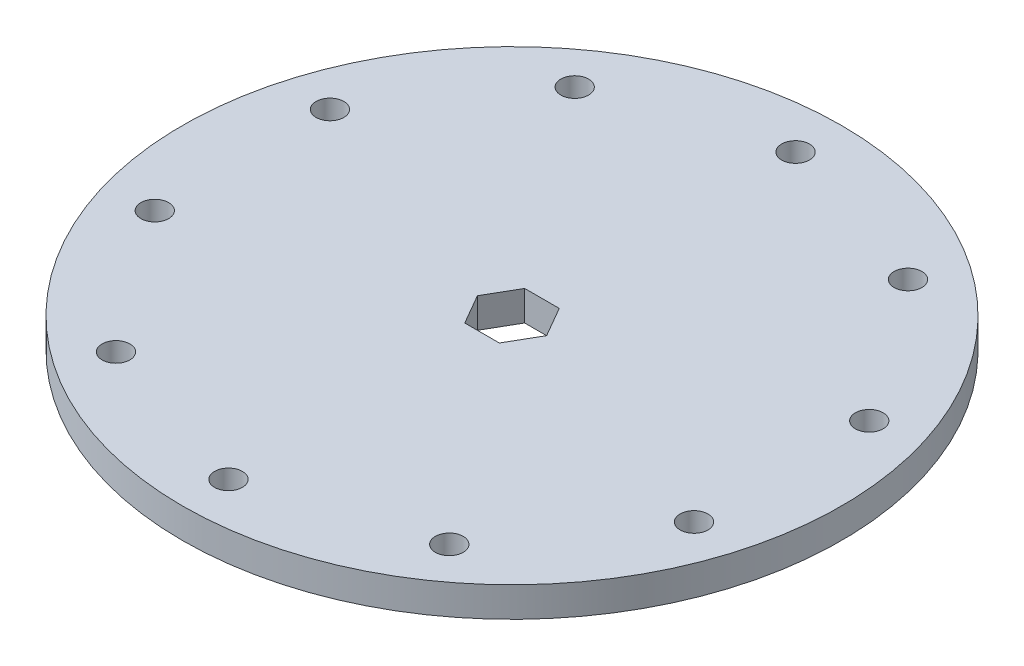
SolidWorks part; units mm, degrees
ref_plane "Front Plane" through (0, 0, 0) normal (0, 0, 1) x (1, 0, 0)
ref_plane "Top Plane" through (0, 0, 0) normal (0, 1, 0) x (1, 0, 0)
ref_plane "Right Plane" through (0, 0, 0) normal (1, 0, 0) x (0, 0, -1)
sketch "Sketch1" plane through (0, 0, 0) normal (0, 1, 0) x (1, 0, 0)
  line L0 (-52.8667, 0) -> (50.5636, 0) construction
  line L1 (1.8331, 3.175) -> (-1.8331, 3.175)
  line L2 (-1.8331, 3.175) -> (-3.6662, 0)
  line L3 (-3.6662, 0) -> (-1.8331, -3.175)
  line L4 (-1.8331, -3.175) -> (1.8331, -3.175)
  line L5 (1.8331, -3.175) -> (3.6662, 0)
  line L6 (3.6662, 0) -> (1.8331, 3.175)
  line L7 (0, 64.4869) -> (0, -49.412) construction
  circle A0 centre (0, 0) radius 34.925
  circle A1 centre (0, 0) radius 3.175 construction
  dimension "D1" = 69.85
  dimension "D2" = 6.35
extrude "Boss-Extrude1" add sketch "Sketch1" along normal blind 3.175
hole_wizard "#4 Clearance Hole1" positions "Sketch4" profile "Sketch2" hole size "#4" standard "ANSI Inch"
sketch "Sketch4" plane through (0, 3.175, 0) normal (0, 1, 0) x (1, 0, 0)
  line L1 (0, 30.0455) -> (-17.6603, 24.3073) construction
  line L2 (-17.6603, 24.3073) -> (-28.575, 9.2846) construction
  line L3 (-28.575, 9.2846) -> (-28.575, -9.2846) construction
  line L4 (-28.575, -9.2846) -> (-17.6603, -24.3073) construction
  line L5 (-17.6603, -24.3073) -> (0, -30.0455) construction
  line L6 (0, -30.0455) -> (17.6603, -24.3073) construction
  line L7 (17.6603, -24.3073) -> (28.575, -9.2846) construction
  line L8 (28.575, -9.2846) -> (28.575, 9.2846) construction
  line L9 (28.575, 9.2846) -> (17.6603, 24.3073) construction
  line L10 (17.6603, 24.3073) -> (0, 30.0455) construction
  line L12 (0, 0) -> (28.575, 9.2846) construction
  line L15 (0, 0) -> (49.099, 0) construction
  circle A0 centre (0, 0) radius 28.575 construction
  point P3 (0, 30.0455)
  point P4 (-17.6603, 24.3073)
  point P5 (-28.575, 9.2846)
  point P6 (-28.575, -9.2846)
  point P7 (-17.6603, -24.3073)
  point P8 (0, -30.0455)
  point P9 (17.6603, -24.3073)
  point P10 (28.575, -9.2846)
  point P11 (28.575, 9.2846)
  point P12 (17.6603, 24.3073)
  dimension "D1" = 57.15
  dimension "D2" = 18
sketch "Sketch2" plane through (0, 3.175, -30.0455) normal (1, 0, 0) x (0, 0, 1)
  line L0 (0, 0) -> (0, 3.175)
  line L1 (0, 3.175) -> (1.4732, 3.175)
  line L2 (1.4732, 3.175) -> (1.4732, 0)
  line L5 (1.4732, 0) -> (0, 0)
  line L11 (0, -6.35) -> (0, 107.95) construction
  dimension "Thru Hole Dia." = 2.9464
  dimension "Thru Hole Depth" = 3.175
